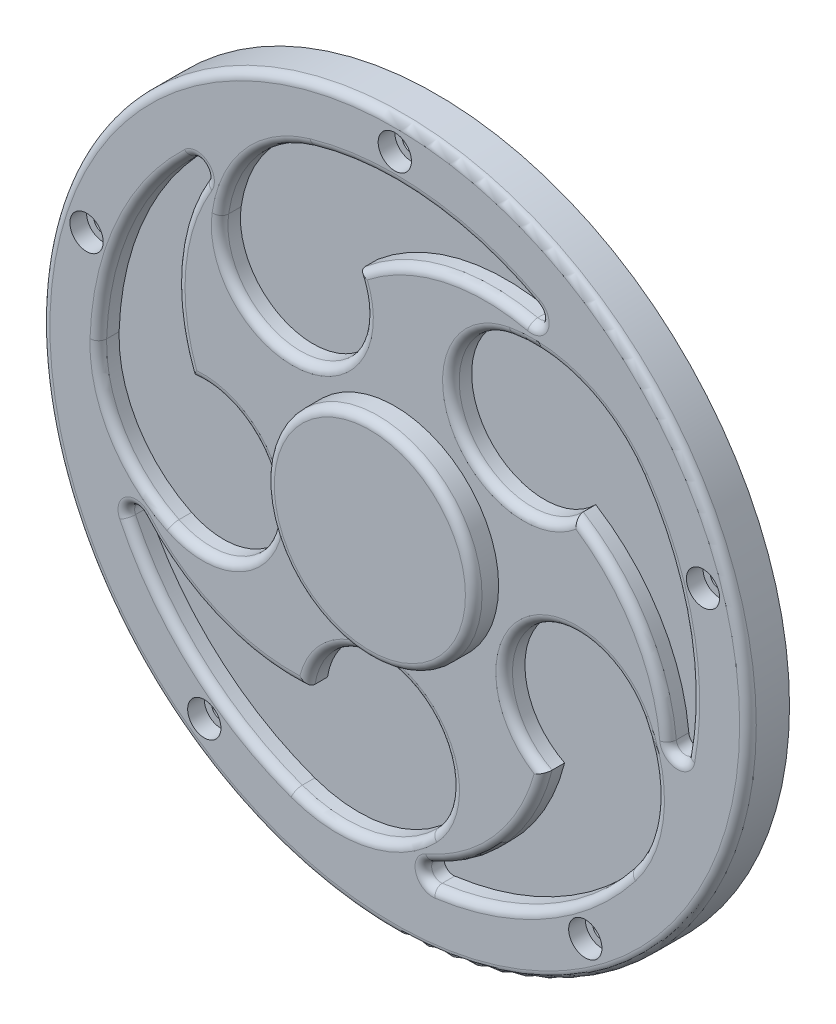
SolidWorks part; units mm, degrees
ref_plane "Front Plane" through (0, 0, 0) normal (0, 0, 1) x (1, 0, 0)
ref_plane "Top Plane" through (0, 0, 0) normal (0, 1, 0) x (1, 0, 0)
ref_plane "Right Plane" through (0, 0, 0) normal (1, 0, 0) x (0, 0, -1)
sketch "Sketch1" plane through (0, 0, 0) normal (0, 0, 1) x (1, 0, 0)
  circle A0 centre (0, 0) radius 85
  dimension "D1" = 170
extrude "Boss-Extrude1" add sketch "Sketch1" against normal blind 10
sketch "Sketch2" plane through (0, 0, 0) normal (0, 0, 1) x (1, 0, 0)
  circle A0 centre (0, 0) radius 25
  dimension "D1" = 50
extrude "Boss-Extrude2" add sketch "Sketch2" along normal blind 6
fillet "Fillet1" radius 2 2 edges at (85, 0, 0) (25, 0, 6)
sketch "Sketch3" plane through (0, 0, 0) normal (0, 0, 1) x (1, 0, 0)
  line L0 (0, 0) -> (0, 83) construction
  line L1 (0, 0) -> (59.9364, 19.4745) construction
  line L2 (31, 36) -> (27.9612, 53.2341) construction
  line L3 (31, 36) -> (31, 53.5) construction
  line L4 (31, 36) -> (43.3744, 23.6256) construction
  circle A0 centre (0, 0) radius 83 construction
  arc A1 (27.9612, 53.2341) -> (43.3744, 23.6256) centre (31, 36) ccw
  arc A2 (43.3744, 23.6256) -> (65.7594, -12.7057) centre (17.9605, -17.0946) cw
  arc A3 (27.9612, 53.2341) -> (59.0833, 40.07) centre (33.3586, 22.6237) cw
  arc A4 (59.0833, 40.07) -> (70.2129, -12.9068) centre (0, 0) cw
  arc A5 (70.2129, -12.9068) -> (65.7594, -12.7057) centre (68, -12.5) cw
  dimension "D2" = 35
  dimension "D7" = 48
  dimension "D8" = 12.5
  dimension "D9" = 68
  dimension "D10" = 2.25
  dimension "D1" = 72
  dimension "D3" = 31
  dimension "D4" = 36
  dimension "D5" = 10
  dimension "D6" = 135
extrude "Cut-Extrude1" cut sketch "Sketch3" against normal blind 5
fillet "Fillet3" radius 2 5 edges at (58.8264, 8.0844, 0) (67.8985, -14.7477, 0) (69.8642, 14.6774, 0) (15.4773, 27.9194, 0) (45.4674, 51.2508, 0)
pattern_circular "CirPattern1" count 5 over 360 about axis through (0, 0, 0) along (0, 0, 1) of "Cut-Extrude1", "Fillet3"
hole_wizard "CBORE for M4 SHCS1" positions "Sketch5" profile "Sketch6" counterbore size "M4" standard "ANSI Metric"
sketch "Sketch5" plane through (0, 0, 0) normal (0, 0, 1) x (1, 0, 0)
  line L0 (0, 0) -> (0, 83) construction
  circle A0 centre (0, 0) radius 83 construction
  point P8 (0, 78)
  point P16 (74.1824, 24.1033)
  point P17 (45.8472, -63.1033)
  point P18 (-45.8472, -63.1033)
  point P19 (-74.1824, 24.1033)
  dimension "D1" = 78
  dimension "D2" = 5
sketch "Sketch6" plane through (-74.1824, 24.1033, 0) normal (1, 0, 0) x (0, -1, 0)
  line L0 (0, 0) -> (0, 10)
  line L1 (0, 10) -> (2.25, 10)
  line L3 (2.25, 10) -> (2.25, 4)
  line L4 (2.25, 4) -> (4, 4)
  line L5 (4, 4) -> (4, 0)
  line L7 (4, 0) -> (0, 0)
  line L11 (0, -6.35) -> (0, 107.95) construction
  dimension "Thru Hole Dia." = 4.5
  dimension "Thru Hole Depth" = 10
  dimension "C'Bore Dia." = 8
  dimension "C'Bore Depth" = 4
ref_plane "Plane1" through (0, 0, -14) normal (0, 0, -1) x (-1, 0, 0)
sketch "Sketch7" plane through (0, 0, -14) normal (0, 0, -1) x (-1, 0, 0)
  circle A0 centre (0, 0) radius 85
  dimension "D1" = 170
sketch "Sketch8" [suppressed] plane through (0, 0, 6) normal (0, 0, 1) x (1, 0, 0)
  line L0 (0, 0) -> (0, 23) construction
  line L1 (0, 0) -> (23, 0) construction
  line L2 (0, 0) -> (0, -23) construction
  line L3 (21.8427, 4.7794) -> (8.5215, 4.7794)
  line L4 (6.1993, 3.3574) -> (2.7336, 3.3574)
  line L5 (2.7336, 3.3574) -> (2.7336, 8.3829)
  line L6 (2.7336, 8.3829) -> (1.8513, 6.017)
  line L7 (-2.7336, 8.3829) -> (-1.8513, 6.017)
  line L8 (-2.7336, 3.3574) -> (-2.7336, 8.3829)
  line L9 (-6.1993, 3.3574) -> (-2.7336, 3.3574)
  line L10 (-21.8427, 4.7794) -> (-8.5215, 4.7794)
  circle A0 centre (0, 0) radius 23 construction
  arc A1 (21.8427, 4.7794) -> (16.7787, -2.9574) centre (26.3128, -3.6721) ccw
  arc A2 (16.7787, -2.9574) -> (6.1993, -4.183) centre (13.8899, -24.2943) ccw
  arc A3 (8.5215, 4.7794) -> (6.1993, 3.3574) centre (6.5814, 5.3406) cw
  arc A4 (1.8513, 6.017) -> (0, 6.0648) centre (0.8067, 1.4328) ccw
  arc A5 (6.1993, -4.183) -> (0, -9.2387) centre (10.7561, -16.0991) ccw
  arc A6 (-6.1993, -4.183) -> (0, -9.2387) centre (-10.7561, -16.0991) cw
  arc A7 (-1.8513, 6.017) -> (0, 6.0648) centre (-0.8067, 1.4328) cw
  arc A8 (-8.5215, 4.7794) -> (-6.1993, 3.3574) centre (-6.5814, 5.3406) ccw
  arc A9 (-16.7787, -2.9574) -> (-6.1993, -4.183) centre (-13.8899, -24.2943) cw
  arc A10 (-21.8427, 4.7794) -> (-16.7787, -2.9574) centre (-26.3128, -3.6721) cw
